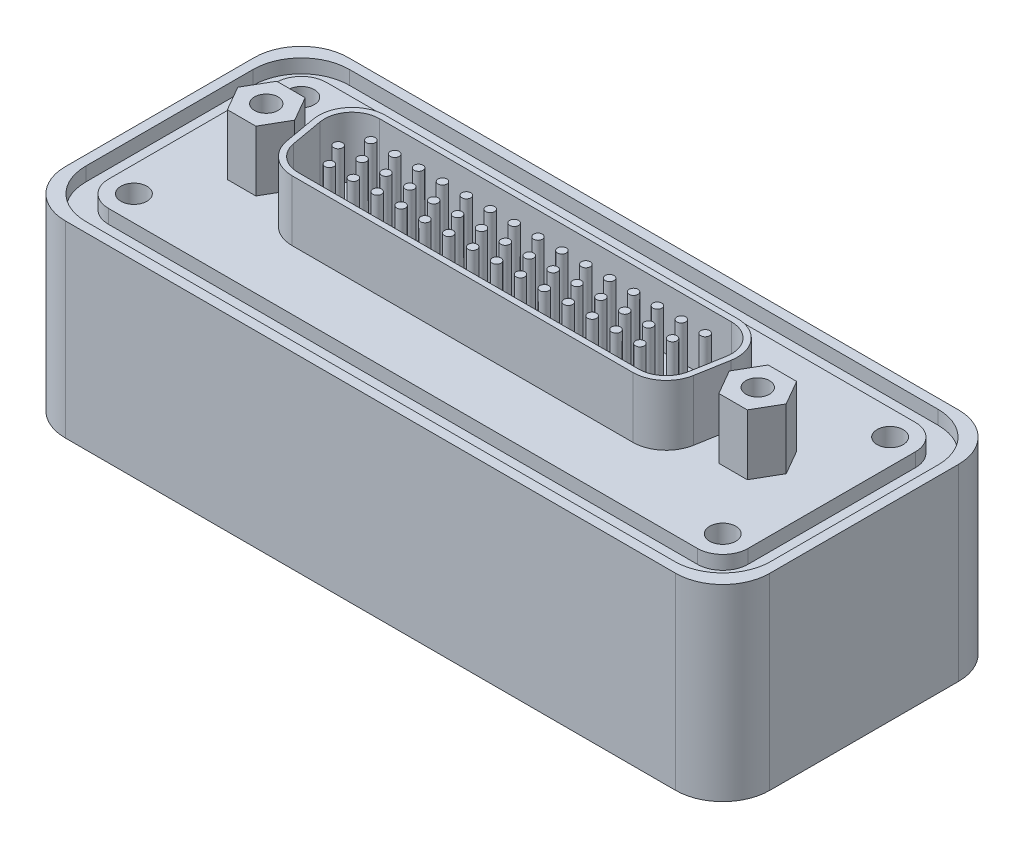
SolidWorks part; units mm, degrees
ref_plane "Front Plane" through (0, 0, 0) normal (0, 0, 1) x (1, 0, 0)
ref_plane "Top Plane" through (0, 0, 0) normal (0, 1, 0) x (1, 0, 0)
ref_plane "Right Plane" through (0, 0, 0) normal (1, 0, 0) x (0, 0, -1)
sketch "Sketch1" plane through (0, 0, 0) normal (0, 1, 0) x (1, 0, 0)
  line L1 (-33.71, -13.54) -> (33.71, -13.54)
  line L2 (-33.71, -13.54) -> (-33.71, 13.54)
  line L3 (-33.71, 13.54) -> (33.71, 13.54)
  line L4 (33.71, -13.54) -> (33.71, 13.54)
  line L5 (-33.71, -13.54) -> (33.71, 13.54) construction
  line L6 (-33.71, 13.54) -> (33.71, -13.54) construction
  point P0 (0, 0)
  dimension "D1" = 67.42
  dimension "D2" = 27.08
extrude "Boss-Extrude1" add sketch "Sketch1" along normal mid plane 18
fillet "Fillet1" radius 4.5 4 edges at (-33.71, 0, -13.54) (-33.71, 0, 13.54) (33.71, 0, -13.54) (33.71, 0, 13.54)
hole_wizard "M3x0.5 Tapped Hole1" positions "Sketch3" profile "Sketch2" tap size "M3x0.5" standard "Ansi Metric"
sketch "Sketch3" plane through (0, 9, 0) normal (0, 1, 0) x (-1, 0, 0)
  point P0 (28.18, -8.01)
  point P1 (-28.18, -8.01)
  point P3 (-28.18, 8.01)
  point P5 (28.18, 8.01)
  dimension "D1" = 28.18
  dimension "D2" = 56.36
  dimension "D3" = 8.01
  dimension "D4" = 16.02
sketch "Sketch2" plane through (-28.18, 9, -8.01) normal (1, 0, 0) x (0, 0, 1)
  line L0 (0, 0) -> (0, 8.2511)
  line L1 (0, 8.2511) -> (1.25, 7.5)
  line L2 (1.25, 7.5) -> (1.25, 0)
  line L5 (1.25, 0) -> (0, 0)
  line L10 (0, 8.2511) -> (-1.25, 7.5) construction
  line L11 (0, -6.35) -> (0, 107.95) construction
  dimension "Tap Drill Dia." = 2.5
  dimension "Tap Drill Depth" = 7.5
  dimension "Drill Angle" = 118
sketch "Sketch4" plane through (0, 9, 0) normal (0, 1, 0) x (1, 0, 0)
  line L1 (-28.18, 10.4383) -> (28.18, 10.4383)
  line L2 (-30.6083, 8.01) -> (-30.6083, -8.01)
  line L3 (-28.18, -10.4383) -> (28.18, -10.4383)
  line L4 (30.6083, 8.01) -> (30.6083, -8.01)
  line L5 (29.21, 13.54) -> (-29.21, 13.54) construction
  line L6 (-28.18, 12.61) -> (28.18, 12.61)
  line L7 (-32.78, 8.01) -> (-32.78, -8.01)
  line L8 (-28.18, -12.61) -> (28.18, -12.61)
  line L9 (32.78, 8.01) -> (32.78, -8.01)
  arc A0 (-28.18, 10.4383) -> (-30.6083, 8.01) centre (-28.18, 8.01) ccw
  arc A1 (30.6083, 8.01) -> (28.18, 10.4383) centre (28.18, 8.01) ccw
  arc A2 (-30.6083, -8.01) -> (-28.18, -10.4383) centre (-28.18, -8.01) ccw
  arc A3 (28.18, -10.4383) -> (30.6083, -8.01) centre (28.18, -8.01) ccw
  arc A4 (-28.18, 12.61) -> (-32.78, 8.01) centre (-28.18, 8.01) ccw
  arc A5 (32.78, 8.01) -> (28.18, 12.61) centre (28.18, 8.01) ccw
  arc A6 (-32.78, -8.01) -> (-28.18, -12.61) centre (-28.18, -8.01) ccw
  arc A7 (28.18, -12.61) -> (32.78, -8.01) centre (28.18, -8.01) ccw
  dimension "D1" = 2.1717
  dimension "D2" = 2.1717
  dimension "D3" = 2.1717
  dimension "D4" = 2.1717
  dimension "D5" = 0.93
  dimension "D6" = 30.6083
extrude "Cut-Extrude1" cut sketch "Sketch4" against normal blind 1.3208
mirror "Mirror1" about plane through (0, 0, 0) normal (0, 1, 0) of "Cut-Extrude1", "M3x0.5 Tapped Hole1"
sketch "Sketch5" plane through (0, 9, 0) normal (0, 1, 0) x (1, 0, 0)
  line L0 (-16.8402, 4.1783) -> (16.8402, 4.1783)
  line L1 (-16.2983, -4.1783) -> (16.2983, -4.1783)
  line L2 (18.8998, -1.9954) -> (19.4417, 1.078)
  line L3 (-18.8998, -1.9954) -> (-19.4417, 1.078)
  line L4 (-16.8402, 4.7371) -> (16.8402, 4.7371)
  line L5 (19.4501, -2.0924) -> (19.992, 0.981)
  line L6 (-16.2983, -4.7371) -> (16.2983, -4.7371)
  line L7 (-19.4501, -2.0924) -> (-19.992, 0.981)
  line L9 (-20.7953, 0) -> (-22.1579, 2.36)
  line L10 (-22.1579, 2.36) -> (-24.8829, 2.36)
  line L11 (-24.8829, 2.36) -> (-26.2455, 0)
  line L12 (-26.2455, 0) -> (-24.8829, -2.36)
  line L13 (-24.8829, -2.36) -> (-22.1579, -2.36)
  line L14 (-22.1579, -2.36) -> (-20.7953, 0)
  line L15 (24.8829, -2.36) -> (26.2455, 0)
  line L16 (26.2455, 0) -> (24.8829, 2.36)
  line L17 (24.8829, 2.36) -> (22.1579, 2.36)
  line L18 (22.1579, 2.36) -> (20.7953, 0)
  line L19 (20.7953, 0) -> (22.1579, -2.36)
  line L20 (22.1579, -2.36) -> (24.8829, -2.36)
  arc A0 (-16.8402, 4.1783) -> (-19.4417, 1.078) centre (-16.8402, 1.5367) ccw
  arc A1 (19.4417, 1.078) -> (16.8402, 4.1783) centre (16.8402, 1.5367) ccw
  arc A2 (-18.8998, -1.9954) -> (-16.2983, -4.1783) centre (-16.2983, -1.5367) ccw
  arc A3 (16.2983, -4.1783) -> (18.8998, -1.9954) centre (16.2983, -1.5367) ccw
  arc A4 (19.992, 0.981) -> (16.8402, 4.7371) centre (16.8402, 1.5367) ccw
  arc A5 (16.2983, -4.7371) -> (19.4501, -2.0924) centre (16.2983, -1.5367) ccw
  arc A6 (-19.4501, -2.0924) -> (-16.2983, -4.7371) centre (-16.2983, -1.5367) ccw
  arc A7 (-16.8402, 4.7371) -> (-19.992, 0.981) centre (-16.8402, 1.5367) ccw
  circle A8 centre (-23.5204, 0) radius 2.36 construction
  circle A9 centre (23.5204, 0) radius 2.36 construction
  dimension "D1" = 5.2832
  dimension "D2" = 4.1783
  dimension "D3" = 8.3566
  dimension "D4" = 33.6804
  dimension "D5" = 16.8402
  dimension "D6" = 32.5966
  dimension "D7" = 16.2983
  dimension "D9" = 23.5204
  dimension "D10" = 47.0408
  dimension "D11" = 4.72
  dimension "D8" = 0.5588
extrude "Boss-Extrude2" add sketch "Sketch5" along normal blind 5.7912
hole_wizard "#4-40 Tapped Hole1" positions "Sketch7" profile "Sketch6" tap size "#4-40" standard "Ansi Inch"
sketch "Sketch7" plane through (0, 14.7912, 0) normal (0, 1, 0) x (-1, 0, 0)
  line L0 (20.7953, 0) -> (26.2455, 0) construction
  line L2 (-26.2455, 0) -> (-20.7953, 0) construction
  point P0 (23.5204, 0)
  point P1 (-23.5204, 0)
sketch "Sketch6" plane through (-23.5204, 14.7912, 0) normal (1, 0, 0) x (0, 0, 1)
  line L0 (0, 0) -> (0, 8.2792)
  line L1 (0, 8.2792) -> (1.1303, 7.6)
  line L2 (1.1303, 7.6) -> (1.1303, 0)
  line L5 (1.1303, 0) -> (0, 0)
  line L10 (0, 8.2792) -> (-1.1303, 7.6) construction
  line L11 (0, -6.35) -> (0, 107.95) construction
  dimension "Tap Drill Dia." = 2.2606
  dimension "Tap Drill Depth" = 7.6
  dimension "Drill Angle" = 118
sketch "Sketch8" plane through (0, -9, 0) normal (0, -1, 0) x (1, 0, 0)
  line L0 (16.6497, -3.9497) -> (-16.6497, -3.9497)
  line L1 (16.1526, 3.9497) -> (-16.1526, 3.9497)
  line L2 (-18.654, 1.8508) -> (-19.1511, -0.9686)
  line L3 (18.654, 1.8508) -> (19.1511, -0.9686)
  line L5 (22.1579, 2.36) -> (20.7953, 0)
  line L6 (20.7953, 0) -> (22.1579, -2.36)
  line L7 (22.1579, -2.36) -> (24.8829, -2.36)
  line L8 (24.8829, -2.36) -> (26.2455, 0)
  line L9 (26.2455, 0) -> (24.8829, 2.36)
  line L10 (24.8829, 2.36) -> (22.1579, 2.36)
  line L11 (-26.2455, 0) -> (-24.8829, -2.36)
  line L12 (-24.8829, -2.36) -> (-22.1579, -2.36)
  line L13 (-22.1579, -2.36) -> (-20.7953, 0)
  line L14 (-20.7953, 0) -> (-22.1579, 2.36)
  line L15 (-22.1579, 2.36) -> (-24.8829, 2.36)
  line L16 (-24.8829, 2.36) -> (-26.2455, 0)
  arc A0 (16.6497, -3.9497) -> (19.1511, -0.9686) centre (16.6497, -1.4097) ccw
  arc A1 (-19.1511, -0.9686) -> (-16.6497, -3.9497) centre (-16.6497, -1.4097) ccw
  arc A2 (18.654, 1.8508) -> (16.1526, 3.9497) centre (16.1526, 1.4097) ccw
  arc A3 (-16.1526, 3.9497) -> (-18.654, 1.8508) centre (-16.1526, 1.4097) ccw
  circle A4 centre (23.5204, 0) radius 2.36 construction
  circle A5 centre (-23.5204, 0) radius 2.36 construction
  dimension "D1" = 5.08
  dimension "D2" = 3.9497
  dimension "D3" = 7.8994
  dimension "D4" = 16.6497
  dimension "D5" = 33.2994
  dimension "D6" = 16.1526
  dimension "D7" = 32.3051
  dimension "D8" = 23.5204
  dimension "D9" = 47.0408
  dimension "D10" = 4.72
extrude "Boss-Extrude3" add sketch "Sketch8" along normal blind 6.1658
hole_wizard "#4-40 Tapped Hole2" positions "Sketch10" profile "Sketch9" tap size "#4-40" standard "Ansi Inch"
sketch "Sketch10" plane through (0, -15.1658, 0) normal (0, -1, 0) x (1, 0, 0)
  line L0 (-26.2455, 0) -> (-20.7953, 0) construction
  line L1 (20.7953, 0) -> (26.2455, 0) construction
  point P0 (-23.5204, 0)
  point P1 (23.5204, 0)
sketch "Sketch9" plane through (-23.5204, -15.1658, 0) normal (1, 0, 0) x (0, 0, -1)
  line L0 (0, 0) -> (0, 8.2792)
  line L1 (0, 8.2792) -> (1.1303, 7.6)
  line L2 (1.1303, 7.6) -> (1.1303, 0)
  line L5 (1.1303, 0) -> (0, 0)
  line L10 (0, 8.2792) -> (-1.1303, 7.6) construction
  line L11 (0, -6.35) -> (0, 107.95) construction
  dimension "Tap Drill Dia." = 2.2606
  dimension "Tap Drill Depth" = 7.6
  dimension "Drill Angle" = 118
sketch "Sketch11" plane through (0, -15.1658, 0) normal (0, -1, 0) x (1, 0, 0)
  line L0 (-23.5204, 0) -> (23.5204, 0) construction
  circle A0 centre (-16.637, 0) radius 0.4636
  circle A1 centre (-15.494, -1.9812) radius 0.4636
  dimension "D1" = 0.9271
  dimension "D2" = 6.8834
  dimension "D3" = 1.9812
  dimension "D4" = 1.143
extrude "Cut-Extrude2" cut sketch "Sketch11" against normal blind 6
pattern_linear "LPattern1" count 15 spacing 2.286 along (1, 0, 0) of "Cut-Extrude2"
sketch "Sketch12" plane through (0, -15.1658, 0) normal (0, -1, 0) x (1, 0, 0)
  line L0 (-15.494, -1.9812) -> (-15.494, 5.8095) construction
  line L1 (-23.5204, 0) -> (23.5204, 0) construction
  circle A0 centre (-15.494, 1.9812) radius 0.4636
  circle A1 centre (-16.637, 0) radius 0.4636 construction
  dimension "D1" = 1.9812
extrude "Cut-Extrude3" cut sketch "Sketch12" against normal blind 6
pattern_linear "LPattern2" count 14 spacing 2.286 along (1, 0, 0) of "Cut-Extrude3"
sketch "Sketch13" plane through (0, 9, 0) normal (0, 1, 0) x (1, 0, 0)
  line L0 (-23.5204, 0) -> (23.5204, 0) construction
  circle A0 centre (-16.637, 0) radius 0.4223
  circle A1 centre (-15.494, 1.9812) radius 0.4223
  dimension "D1" = 0.8446
  dimension "D2" = 6.8834
  dimension "D3" = 1.9812
  dimension "D4" = 1.143
extrude "Boss-Extrude4" add sketch "Sketch13" along normal up to surface (5.7912 mm away)
pattern_linear "LPattern3" count 15 spacing 2.286 along (1, 0, 0) of "Boss-Extrude4"
sketch "Sketch14" plane through (0, 9, 0) normal (0, 1, 0) x (1, 0, 0)
  line L0 (-23.5204, 0) -> (23.5204, 0) construction
  circle A0 centre (-15.494, -1.9812) radius 0.4223
  circle A1 centre (-16.637, 0) radius 0.4223 construction
  dimension "D1" = 1.9812
  dimension "D2" = 1.143
extrude "Boss-Extrude5" add sketch "Sketch14" along normal up to surface (5.7912 mm away)
pattern_linear "LPattern4" count 14 spacing 2.286 along (1, 0, 0) of "Boss-Extrude5"
